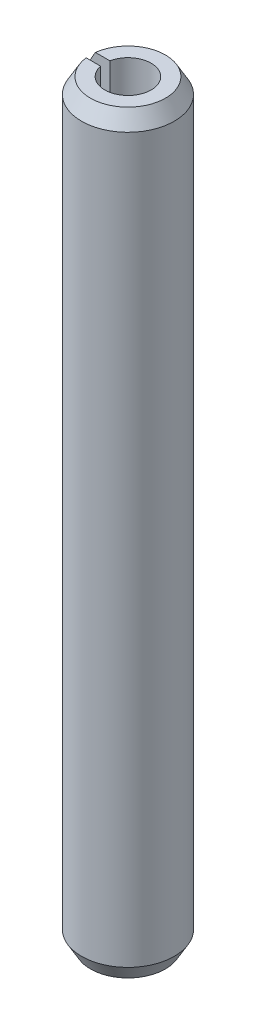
SolidWorks part; units mm, degrees
ref_plane "Plan1" through (0, 0, 0) normal (0, 0, 1) x (1, 0, 0)
ref_plane "Plan2" through (0, 0, 0) normal (0, 1, 0) x (1, 0, 0)
ref_plane "Plan3" through (0, 0, 0) normal (1, 0, 0) x (0, 0, -1)
sketch "Esquisse1" plane through (0, 0, 0) normal (0, 0, 1) x (1, 0, 0)
  line L1 (2, 32.5) -> (2, -32.5)
  line L2 (-4, 0) -> (4, 0) construction
  line L3 (2, 32.5) -> (4, 32.5)
  line L4 (4, -32.5) -> (2, -32.5)
  line L5 (0, 32.5) -> (0, -32.5) construction
  line L6 (4, 32.5) -> (4, -32.5)
  dimension "Epaisseur" = 2
  dimension "Longueur" = 65
  dimension "Diamètre nominal" = 8
revolve "Base-Révolution" add sketch "Esquisse1" angle 360 about L5
chamfer "Chanfrein1" distance 1.3333 angle 30 2 edges at (0, -32.5, 4) (0, 32.5, 4)
sketch "Esquisse2" plane through (0, 0, 0) normal (0, 1, 0) x (-1, 0, 0)
  line L0 (0, 0) -> (4, 0) construction
  line L1 (0, 0.4) -> (0, -0.4)
  line L2 (0, -0.4) -> (4, -0.4)
  line L3 (4, 0.4) -> (4, -0.4)
  line L4 (0, 0.4) -> (4, 0.4)
  circle A1 centre (0, 0) radius 4 construction
  dimension "Frep" = 0.4
extrude "Enlèv. mat.-Extru.1" cut sketch "Esquisse2" against normal through all and the other way through all
equation "\"Ch@Chanfrein1\" = \"Epaisseur@Esquisse1\"/1.5"
equation "\"Frep@Esquisse2\" = (\"Diamètre nominal@Esquisse1\"/2)*0.1"
